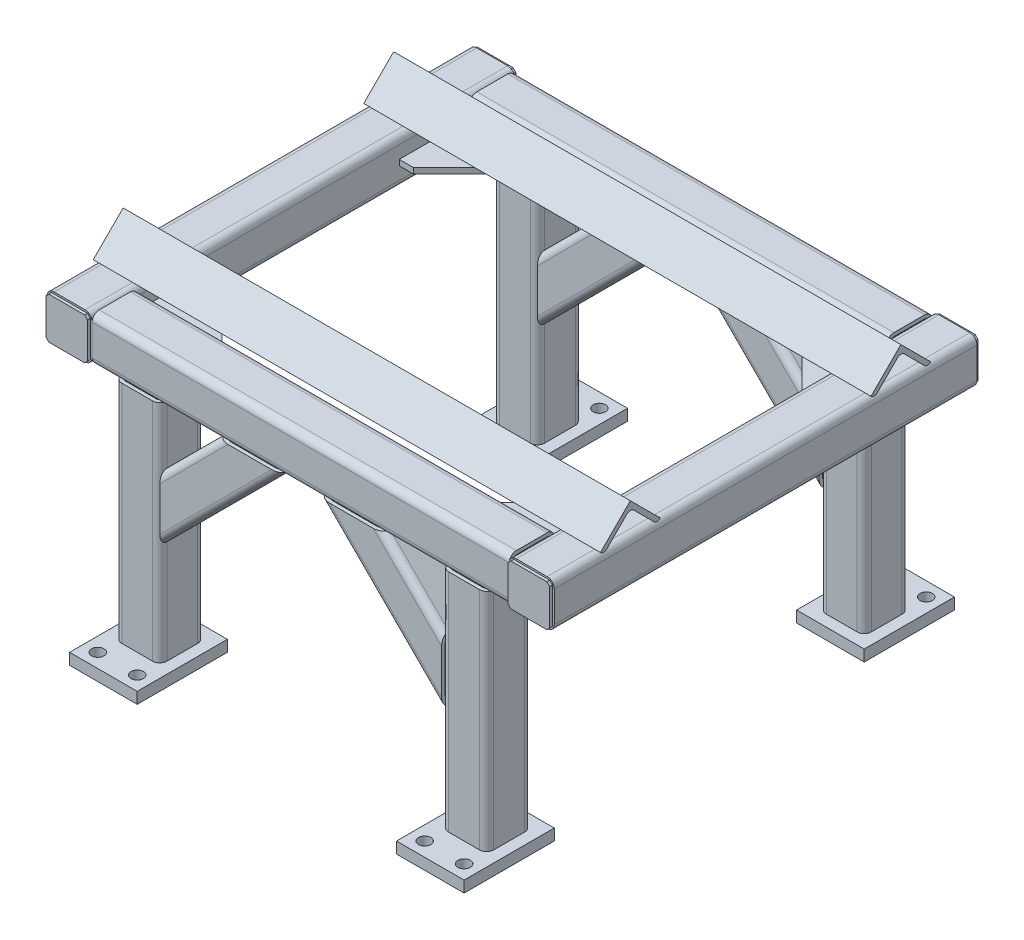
SolidWorks part; units mm, degrees
ref_plane "Default Plane" through (350, 20, -275) normal (0, -1, 0) x (1, 0, 0)
sketch3d "Bounding-Box_BASE PLATES"
  line L0 (-120, 0, 0) -> (-120, -160, 0) construction
  line L1 (-120, -160, 0) -> (0, -160, 0) construction
  line L2 (0, -160, 0) -> (0, 0, 0) construction
  line L3 (0, 0, 0) -> (-120, 0, 0) construction
  line L4 (-120, 0, 20) -> (-120, -160, 20) construction
  line L5 (-120, -160, 20) -> (0, -160, 20) construction
  line L6 (0, -160, 20) -> (0, 0, 20) construction
  line L7 (0, 0, 20) -> (-120, 0, 20) construction
  line L8 (-120, 0, 0) -> (-120, 0, 20) construction
  line L9 (-120, -160, 0) -> (-120, -160, 20) construction
  line L10 (0, -160, 0) -> (0, -160, 20) construction
  line L11 (0, 0, 0) -> (0, 0, 20) construction
ref_plane "Default Plane" through (370, 455, -270) normal (0, 1, 0) x (-1, 0, 0)
sketch3d "Bounding-Box_GUSSETS"
  line L0 (125, -25, 0) -> (125, 100, 0) construction
  line L1 (125, 100, 0) -> (0, 100, 0) construction
  line L2 (0, 100, 0) -> (0, -25, 0) construction
  line L3 (0, -25, 0) -> (125, -25, 0) construction
  line L4 (125, -25, 10) -> (125, 100, 10) construction
  line L5 (125, 100, 10) -> (0, 100, 10) construction
  line L6 (0, 100, 10) -> (0, -25, 10) construction
  line L7 (0, -25, 10) -> (125, -25, 10) construction
  line L8 (125, -25, 0) -> (125, -25, 10) construction
  line L9 (125, 100, 0) -> (125, 100, 10) construction
  line L10 (0, 100, 0) -> (0, 100, 10) construction
  line L11 (0, -25, 0) -> (0, -25, 10) construction
ref_plane "Default Plane" through (446.85, 491.85, -380) normal (0, 0, 1) x (1, 0, 0)
sketch3d "Bounding-Box_END CAPS"
  line L0 (-73.7, -68.7, 0) -> (0, -68.7, 0) construction
  line L1 (0, -68.7, 0) -> (0, 5, 0) construction
  line L2 (0, 5, 0) -> (-73.7, 5, 0) construction
  line L3 (-73.7, 5, 0) -> (-73.7, -68.7, 0) construction
  line L4 (-73.7, -68.7, 5) -> (0, -68.7, 5) construction
  line L5 (0, -68.7, 5) -> (0, 5, 5) construction
  line L6 (0, 5, 5) -> (-73.7, 5, 5) construction
  line L7 (-73.7, 5, 5) -> (-73.7, -68.7, 5) construction
  line L8 (-73.7, -68.7, 0) -> (-73.7, -68.7, 5) construction
  line L9 (0, -68.7, 0) -> (0, -68.7, 5) construction
  line L10 (0, 5, 0) -> (0, 5, 5) construction
  line L11 (-73.7, 5, 0) -> (-73.7, 5, 5) construction
ref_plane "Front Plane" through (0, 0, 0) normal (0, 0, 1) x (1, 0, 0)
ref_plane "Top Plane" through (0, 0, 0) normal (0, 1, 0) x (1, 0, 0)
ref_plane "Right Plane" through (0, 0, 0) normal (1, 0, 0) x (0, 0, -1)
ref_plane "Top of Frame" through (0, 500, 0) normal (0, 1, 0) x (1, 0, 0)
ref_plane "Bottom of Legs" through (0, 20, 0) normal (0, 1, 0) x (1, 0, 0)
sketch "Upper Frame" plane through (0, 500, 0) normal (0, 1, 0) x (1, 0, 0)
  line L0 (-450, 375) -> (450, -375) construction
  line L1 (450, 375) -> (-450, 375)
  line L2 (450, 375) -> (450, -375)
  line L3 (450, -375) -> (-450, -375)
  line L4 (-450, 375) -> (-450, -375)
  dimension "D1" = 900
  dimension "D2" = 750
ref_plane "Front of Frame" through (0, 0, 375) normal (0, 0, 1) x (1, 0, 0)
sketch "Leg Sketch" plane through (0, 0, 375) normal (0, 0, 1) x (1, 0, 0)
  line L0 (-290, 20) -> (-290, 500)
  line L1 (0, 429.9862) -> (0, 0) construction
  line L2 (-290, 220) -> (-10, 500)
  line L3 (450, 500) -> (-450, 500) construction
  line L4 (50, 20) -> (-50, 20) construction
  dimension "D1" = 200
  dimension "D2" = 45
  dimension "D3" = 580
other "Tube (square) 80 X 80 X 6.3(1)"
ref_plane "Plane2" through (410, 460, -375) normal (0, 0, 1) x (1, 0, 0)
sketch "Sketch1" plane through (410, 460, -375) normal (0, 0, 1) x (1, 0, 0)
  line L0 (-27.4, -33.7) -> (27.4, -33.7)
  line L1 (-33.7, -27.4) -> (-33.7, 27.4)
  line L2 (27.4, 33.7) -> (-27.4, 33.7)
  line L3 (33.7, 27.4) -> (33.7, -27.4)
  line L4 (-27.4, -40) -> (27.4, -40)
  line L5 (-40, -27.4) -> (-40, 27.4)
  line L6 (27.4, 40) -> (-27.4, 40)
  line L7 (40, 27.4) -> (40, -27.4)
  line L8 (-40, 0) -> (-33.7, 0) construction
  line L9 (-33.7, 0) -> (33.7, 0) construction
  line L10 (33.7, 0) -> (40, 0) construction
  line L12 (0, 40) -> (0, 33.7) construction
  line L13 (0, 33.7) -> (0, -33.7) construction
  line L14 (0, -33.7) -> (0, -40) construction
  arc A0 (40, 27.4) -> (27.4, 40) centre (27.4, 27.4) ccw
  arc A1 (27.4, -40) -> (40, -27.4) centre (27.4, -27.4) ccw
  arc A2 (-40, -27.4) -> (-27.4, -40) centre (-27.4, -27.4) ccw
  arc A3 (-27.4, 40) -> (-40, 27.4) centre (-27.4, 27.4) ccw
  arc A4 (-27.4, 33.7) -> (-33.7, 27.4) centre (-27.4, 27.4) ccw
  arc A5 (33.7, 27.4) -> (27.4, 33.7) centre (27.4, 27.4) ccw
  arc A6 (27.4, -33.7) -> (33.7, -27.4) centre (27.4, -27.4) ccw
  arc A7 (-33.7, -27.4) -> (-27.4, -33.7) centre (-27.4, -27.4) ccw
  point P2 (-40, 40)
  point P33 (-40, -40)
  point P34 (40, -40)
  point P36 (40, 40)
  point P37 (0, 0)
  dimension "D1" = 12.6
  dimension "Thickness" = 6.3
  dimension "V_leg" = 80
  dimension "H_leg" = 80
sketch "Sketch2" plane through (0, 20, 0) normal (0, 1, 0) x (1, 0, 0)
  line L0 (-290, -375) -> (-290, -435) construction
  line L1 (-350, -435) -> (-230, -435)
  line L2 (-350, -435) -> (-350, -275)
  line L3 (-350, -275) -> (-230, -275)
  line L4 (-230, -435) -> (-230, -275)
  dimension "D1" = 120
  dimension "D2" = 160
  dimension "D3" = 60
extrude "Boss-Extrude1" add sketch "Sketch2" against normal blind 20 separate body
hole_wizard "M20 Clearance Hole1" positions "Sketch3" profile "Sketch4" hole size "M20" standard "ANSI Metric"
sketch "Sketch3" plane through (0, 20, 0) normal (0, 1, 0) x (1, 0, 0)
  line L0 (-325, -410) -> (-255, -410) construction
  line L3 (-290, -375) -> (-290, -410) construction
  line L4 (-317.4, -375) -> (-262.6, -375) construction
  line L6 (-350, -435) -> (-230, -435) construction
  point P0 (-325, -410)
  point P2 (-255, -410)
  dimension "D1" = 25
  dimension "D2" = 70
sketch "Sketch4" plane through (-325, 20, 410) normal (1, 0, 0) x (0, 0, 1)
  line L0 (0, 0) -> (0, 20)
  line L1 (0, 20) -> (11, 20)
  line L2 (11, 20) -> (11, 0)
  line L5 (11, 0) -> (0, 0)
  line L11 (0, -6.35) -> (0, 107.95) construction
  dimension "Thru Hole Dia." = 22
  dimension "Thru Hole Depth" = 20
other "Gusset1" parameters "D1"=10, "D2"=10, "D3"=0, "D4"=0, "D10"=5, "D11"=125, "D12"=125, "D13"=25, "D14"=45, "D15"=25, "D16"=25, "D17"=25, "D18"=45
sketch "Sketch5" plane through (-370, 460, 295) normal (0, 1, 0) x (1, 0, 0)
  line L0 (0, 25) -> (0, 125)
  line L1 (25, 0) -> (125, 0)
  line L2 (0, 25) -> (25, 0)
  line L3 (25, 125) -> (125, 25)
  line L4 (0, 125) -> (25, 125)
  line L5 (125, 0) -> (125, 25)
other "End cap1" parameters "D1"=5, "D2"=3, "D3"=5
mirror "Mirror1" about plane through (0, 0, 0) normal (1, 0, 0)
mirror "Mirror2" about plane through (0, 0, 0) normal (0, 0, 1)
sketch "Rails Sketch" plane through (0, 500, 0) normal (0, 1, 0) x (1, 0, 0)
  line L0 (-450, 0) -> (450, 0) construction
  line L1 (-450, 375) -> (-450, -375) construction
  line L2 (450, -375) -> (450, 375) construction
  line L3 (-450, -240) -> (450, -240)
  line L4 (-450, 240) -> (450, 240)
  line L5 (-450, 375) -> (-450, -375) construction
  dimension "D1" = 480
other "L angle (equal) MODIFIED_75X75X8(1)"
ref_plane "Plane4" through (-450, 555.3762, 240) normal (1, 0, 0) x (0, -0.7071, 0.7071)
sketch "Sketch12" plane through (-450, 555.3762, 240) normal (1, 0, 0) x (0, -0.7071, 0.7071)
  line L0 (0, 75) -> (0, 0)
  line L1 (5.6569, 72.6569) -> (72.6569, 5.6569) construction
  line L2 (8, 67) -> (8, 17)
  line L3 (17, 8) -> (67, 8)
  line L5 (75, 0) -> (0, 0)
  arc A0 (8, 67) -> (0, 75) centre (0, 67) ccw
  arc A1 (75, 0) -> (67, 8) centre (67, 0) ccw
  arc A2 (17, 8) -> (8, 17) centre (17, 17) cw
  point P8 (0, 37.5)
  point P9 (37.5, 0)
  point P11 (39.1569, 39.1569)
  point P16 (0, 0)
  dimension "Radius_2" = 8
  dimension "Radius_1" = 9
  dimension "V_leg" = 75
  dimension "H_leg" = 75
  dimension "thickness" = 8
